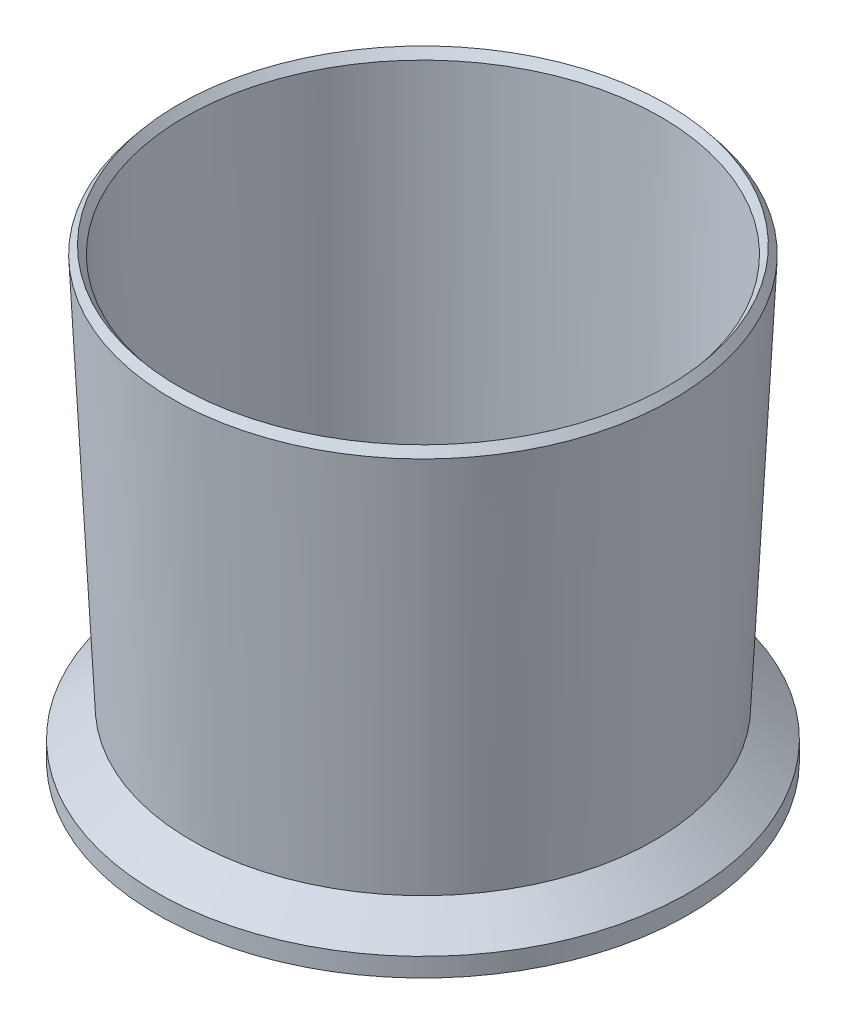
SolidWorks part; units mm, degrees
ref_plane "Front Plane" through (0, 0, 0) normal (0, 0, 1) x (1, 0, 0)
ref_plane "Top Plane" through (0, 0, 0) normal (0, 1, 0) x (1, 0, 0)
ref_plane "Right Plane" through (0, 0, 0) normal (1, 0, 0) x (0, 0, -1)
sketch "Sketch1" plane through (0, 0, 0) normal (0, 0, 1) x (1, 0, 0)
  line L0 (0, -10) -> (0, 1100) construction
  line L1 (0, 0) -> (130, 0)
  line L2 (130, 0) -> (130, 10)
  line L3 (130, 10) -> (162, 10)
  line L4 (162, 10) -> (162, 0)
  line L5 (162, 0) -> (170, 0)
  line L6 (170, 0) -> (170, 12)
  line L7 (170, 12) -> (148, 30)
  line L8 (148, 30) -> (160, 280)
  line L9 (160, 280) -> (156, 285)
  line L10 (156, 285) -> (152, 280)
  line L11 (152, 280) -> (143, 18)
  line L12 (143, 18) -> (100, 18)
  line L13 (100, 18) -> (30, 80)
  line L14 (30, 80) -> (30, 100)
  line L15 (30, 100) -> (13.5, 100)
  line L16 (13.5, 100) -> (13.5, 8)
  line L17 (13.5, 8) -> (0, 8)
  line L18 (0, 8) -> (0, 0)
revolve "Planter Body + Central Socket" add sketch "Sketch1" angle 360 about L0
sketch "Sketch2" plane through (0, 0, 0) normal (0, 1, 0) x (1, 0, 0)
  circle A0 centre (118, 0) radius 6.5
  circle A1 centre (59, 102.191) radius 6.5
  circle A2 centre (-59, 102.191) radius 6.5
  circle A3 centre (-118, 0) radius 6.5
  circle A4 centre (-59, -102.191) radius 6.5
  circle A5 centre (59, -102.191) radius 6.5
extrude "Six Drainage Holes" cut sketch "Sketch2" along normal through all
